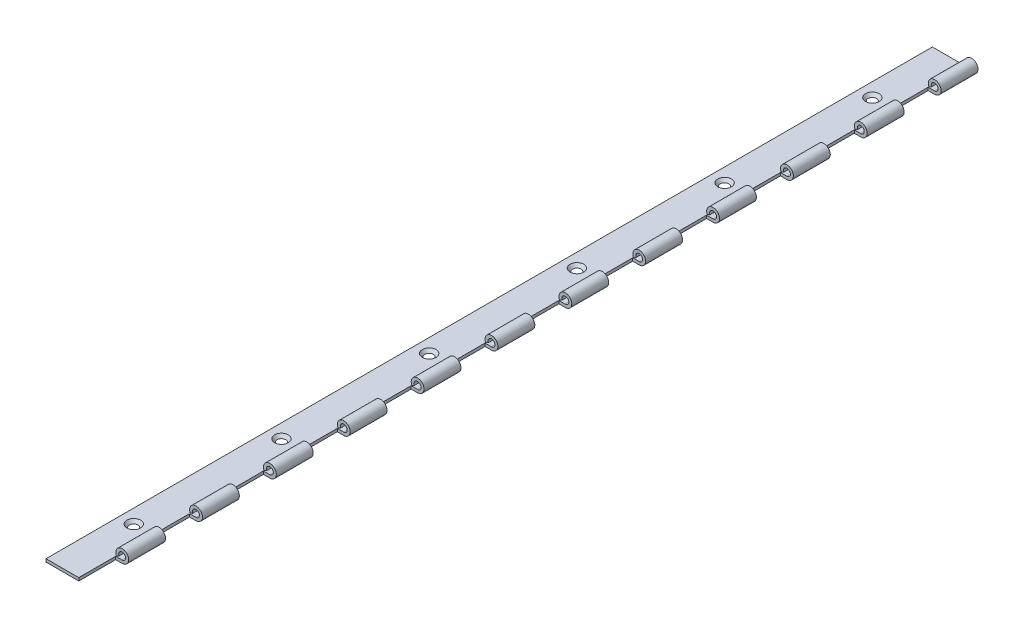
SolidWorks part; units mm, degrees
ref_plane "Front" through (0, 0, 0) normal (0, 0, 1) x (1, 0, 0)
ref_plane "Top" through (0, 0, 0) normal (0, 1, 0) x (1, 0, 0)
ref_plane "Right" through (0, 0, 0) normal (1, 0, 0) x (0, 0, -1)
body saved out of another part "Stock-1575A1_Piano Hinge with Holes-1"
